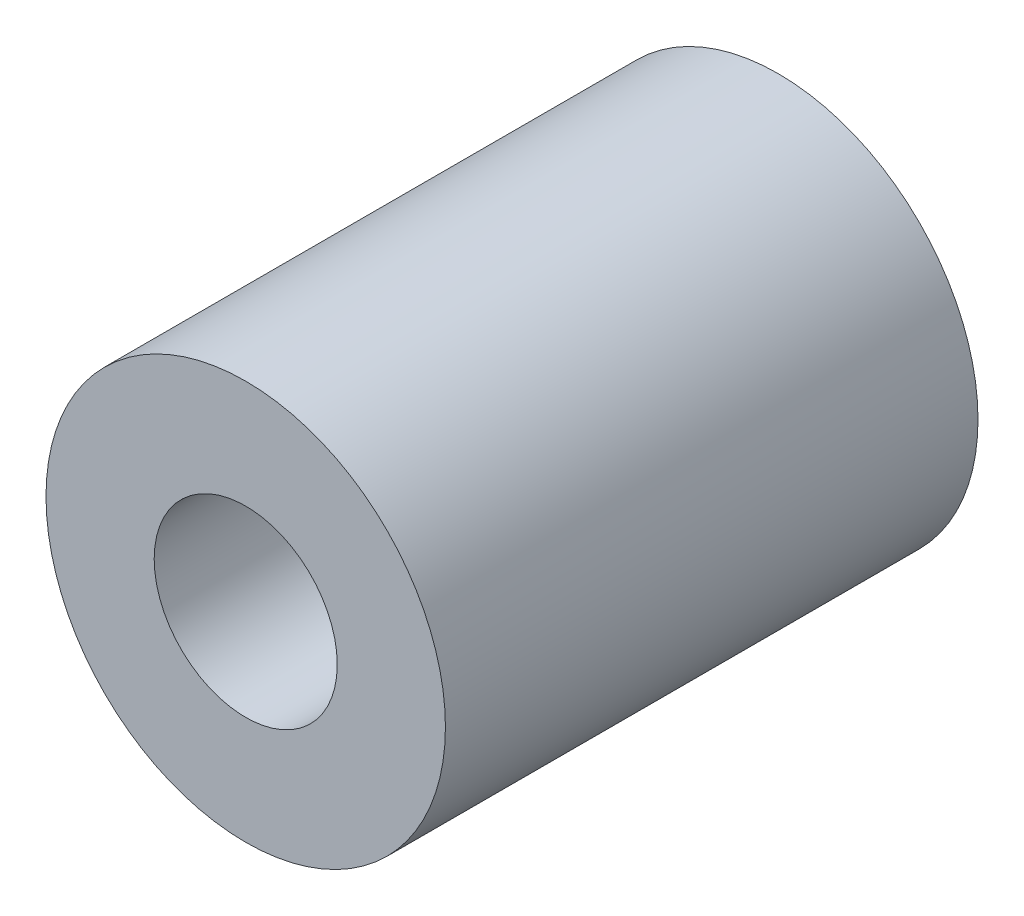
SolidWorks part; units mm, degrees
ref_plane "前视基准面" through (0, 0, 0) normal (0, 0, 1) x (1, 0, 0)
ref_plane "上视基准面" through (0, 0, 0) normal (0, 1, 0) x (1, 0, 0)
ref_plane "右视基准面" through (0, 0, 0) normal (1, 0, 0) x (0, 0, -1)
sketch "草图1" plane through (0, 0, 0) normal (0, 0, 1) x (1, 0, 0)
  circle A0 centre (0, 0) radius 6
extrude "凸台-拉伸1" add sketch "草图1" along normal blind 16
sketch "草图2" plane through (0, 0, 16) normal (0, 0, 1) x (1, 0, 0)
  circle A0 centre (0, 0) radius 2.75
extrude "切除-拉伸1" cut sketch "草图2" against normal blind 16
